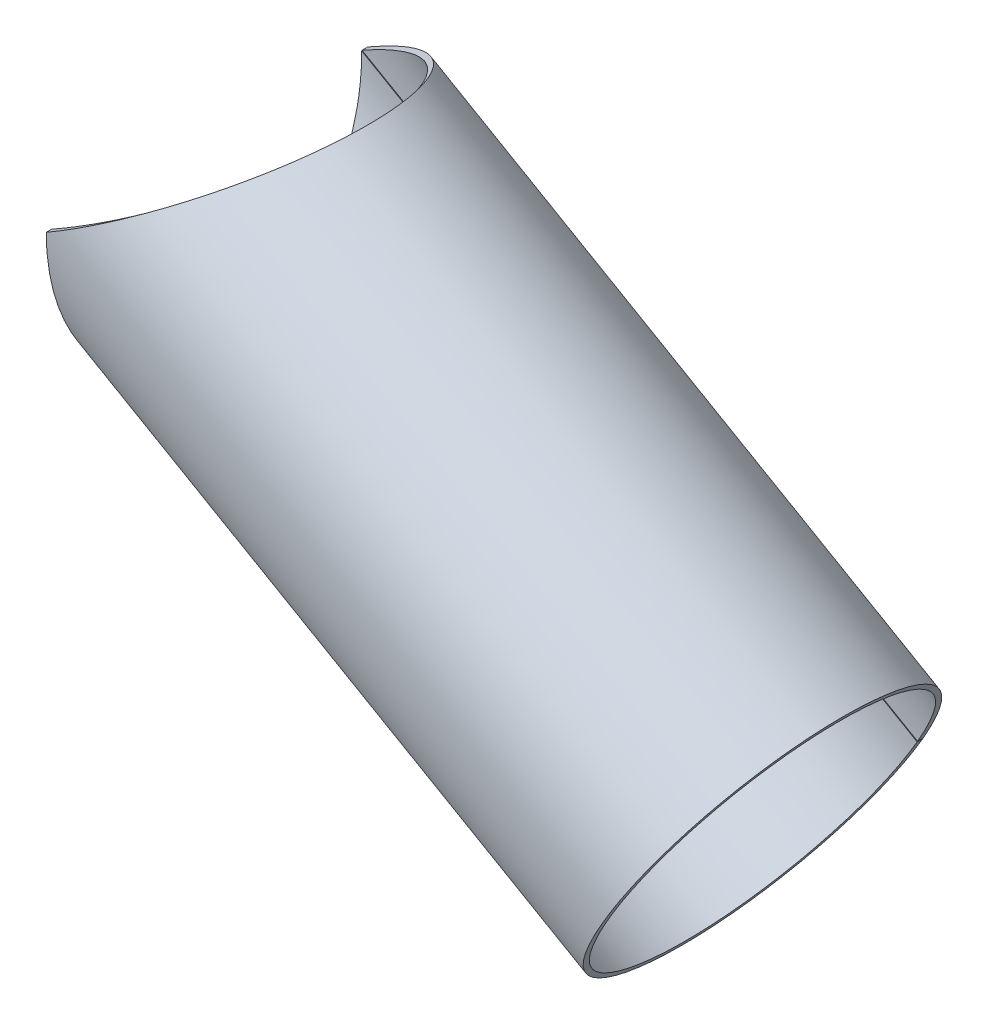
SolidWorks part; units mm, degrees
ref_plane "前视基准面" through (0, 0, 0) normal (0, 0, 1) x (1, 0, 0)
ref_plane "上视基准面" through (0, 0, 0) normal (0, 1, 0) x (1, 0, 0)
ref_plane "右视基准面" through (0, 0, 0) normal (1, 0, 0) x (0, 0, -1)
imported_body "基体零件-等角Y形管-1"
sheet metal parameters "钣金1" parameters "D1"=0.7366, "厚度"=6
bend "圆角折弯1" bend radius 169 bend angle 359.673 parameters "D5"=1
flatten bends "展开-折弯1"
sketch "尖角-草图1" plane through (302.9839, -175.5052, -174.9993) normal (-0.0014, -0.0025, -1) x (-1, 0, 0.0014)
  line L0 (568.2065, -284.4531) -> (-37.7619, -634.3077) construction
  dimension "D1" = 0
process bends "加工-折弯1" parameters "D1"=0
sketch "平面-草图1" plane through (302.9839, -175.5052, -174.9993) normal (-0.0014, -0.0025, -1) x (-1, 0, 0.0014)
